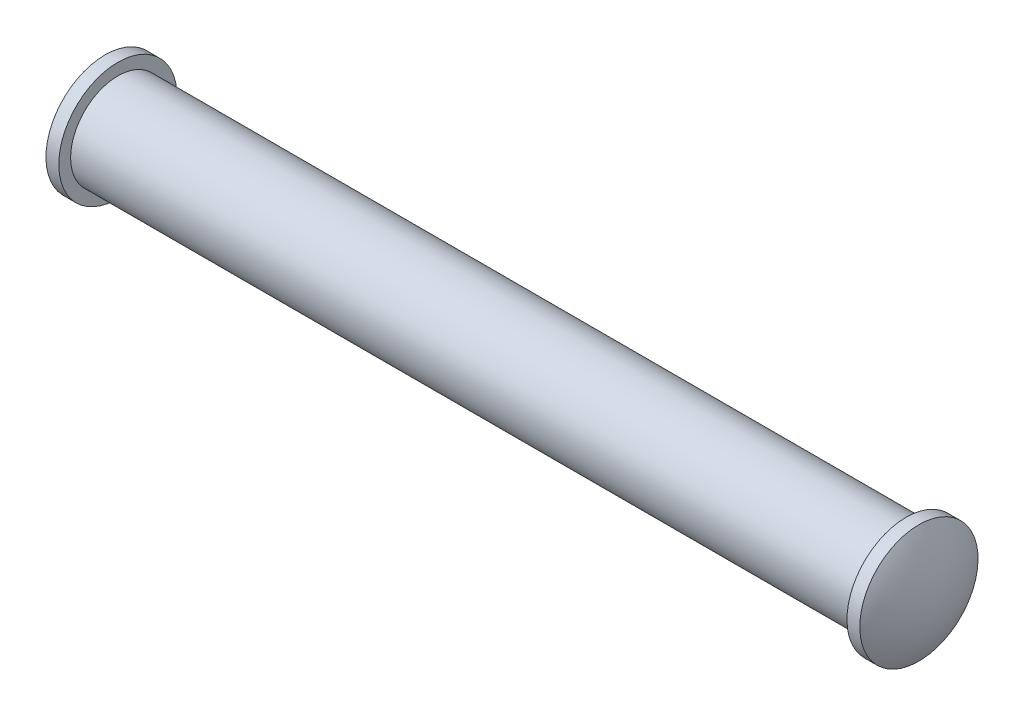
SolidWorks part; units mm, degrees
ref_plane "Front Plane" through (0, 0, 0) normal (0, 0, 1) x (1, 0, 0)
ref_plane "Top Plane" through (0, 0, 0) normal (0, 1, 0) x (1, 0, 0)
ref_plane "Right Plane" through (0, 0, 0) normal (1, 0, 0) x (0, 0, -1)
sketch "Sketch1" plane through (0, 0, 0) normal (1, 0, 0) x (0, 0, -1)
  circle A0 centre (0, 0) radius 4.572
  dimension "D1" = 9.144
extrude "Boss-Extrude1" add sketch "Sketch1" along normal blind 76.2
sketch "Sketch4" plane through (0, 0, 0) normal (0, 0, 1) x (1, 0, 0)
  line L0 (0, 0) -> (-7.4233, 0) construction
  line L1 (-1.2398, -5.715) -> (0, -5.715)
  line L2 (0, -5.715) -> (0, 0)
  line L4 (0, 0) -> (-2.8115, 0)
  arc A0 (-2.8115, 0) -> (-1.2398, -5.715) centre (8.3645, 0) ccw
  dimension "D1" = 22.352
  dimension "D2" = 5.715
  dimension "D3" = 1.2398
revolve "Revolve1" add sketch "Sketch4" angle 360 about L0
ref_plane "Plane1" through (38.1, 0, 0) normal (1, 0, 0) x (0, 0, -1)
mirror "Mirror1" about plane through (38.1, 0, 0) normal (1, 0, 0) of "Revolve1"
